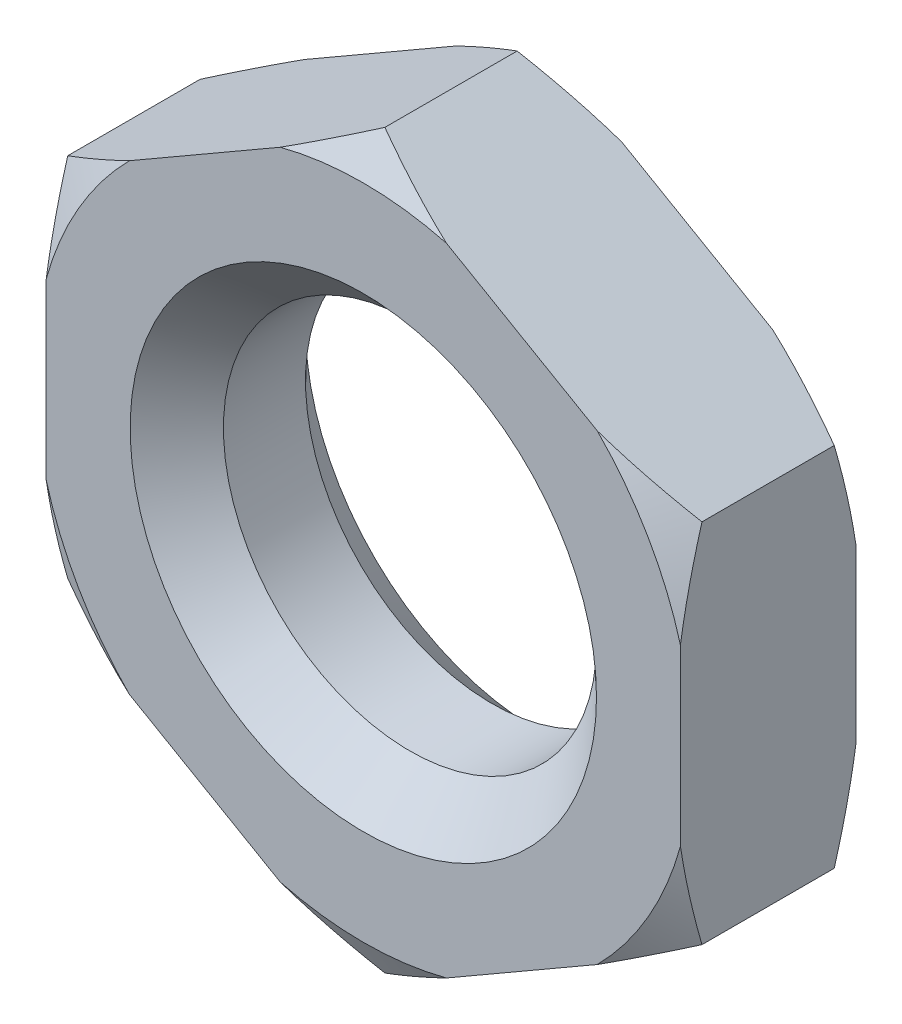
SolidWorks part; units mm, degrees
ref_plane "Front Plane" through (0, 0, 0) normal (0, 0, 1) x (1, 0, 0)
ref_plane "Top Plane" through (0, 0, 0) normal (0, 1, 0) x (1, 0, 0)
ref_plane "Right Plane" through (0, 0, 0) normal (1, 0, 0) x (0, 0, -1)
sketch "Sketch1" plane through (0, 0, 0) normal (0, 0, 1) x (1, 0, 0)
  line L1 (0, 9.815) -> (-8.5, 4.9075)
  line L2 (-8.5, 4.9075) -> (-8.5, -4.9075)
  line L3 (-8.5, -4.9075) -> (0, -9.815)
  line L4 (0, -9.815) -> (8.5, -4.9075)
  line L5 (8.5, -4.9075) -> (8.5, 4.9075)
  line L6 (8.5, 4.9075) -> (0, 9.815)
  circle A0 centre (0, 0) radius 8.5 construction
  circle A1 centre (0, 0) radius 5
  dimension "D2" = 10
  dimension "D1" = 17
extrude "Boss-Extrude1" add sketch "Sketch1" along normal mid plane 4.7
sketch "Sketch2" plane through (0, 0, 0) normal (1, 0, 0) x (0, 0, -1)
  line L0 (7.477, 0) -> (-8.5759, 0) construction
sketch "Sketch3" plane through (0, 0, 0) normal (1, 0, 0) x (0, 0, -1)
  line L0 (-2.35, 9.815) -> (-2.35, 8.815)
  line L1 (-2.35, 4.9075) -> (-2.35, 9.815) construction
  line L2 (-2.35, 8.815) -> (-1.7726, 9.815)
  line L3 (-2.35, 9.815) -> (2.35, 9.815) construction
  line L4 (-1.7726, 9.815) -> (-2.35, 9.815)
  dimension "D1" = 1
  dimension "D2" = 30
revolve "Cut-Revolve1" cut sketch "Sketch3" angle 360 about L0
mirror "Mirror1" about plane through (0, 0, 0) normal (0, 0, 1) of "Cut-Revolve1"
chamfer "Chamfer1" distance 1.25 angle 45 2 edges at (5, 0, -2.35) (5, 0, 2.35)
